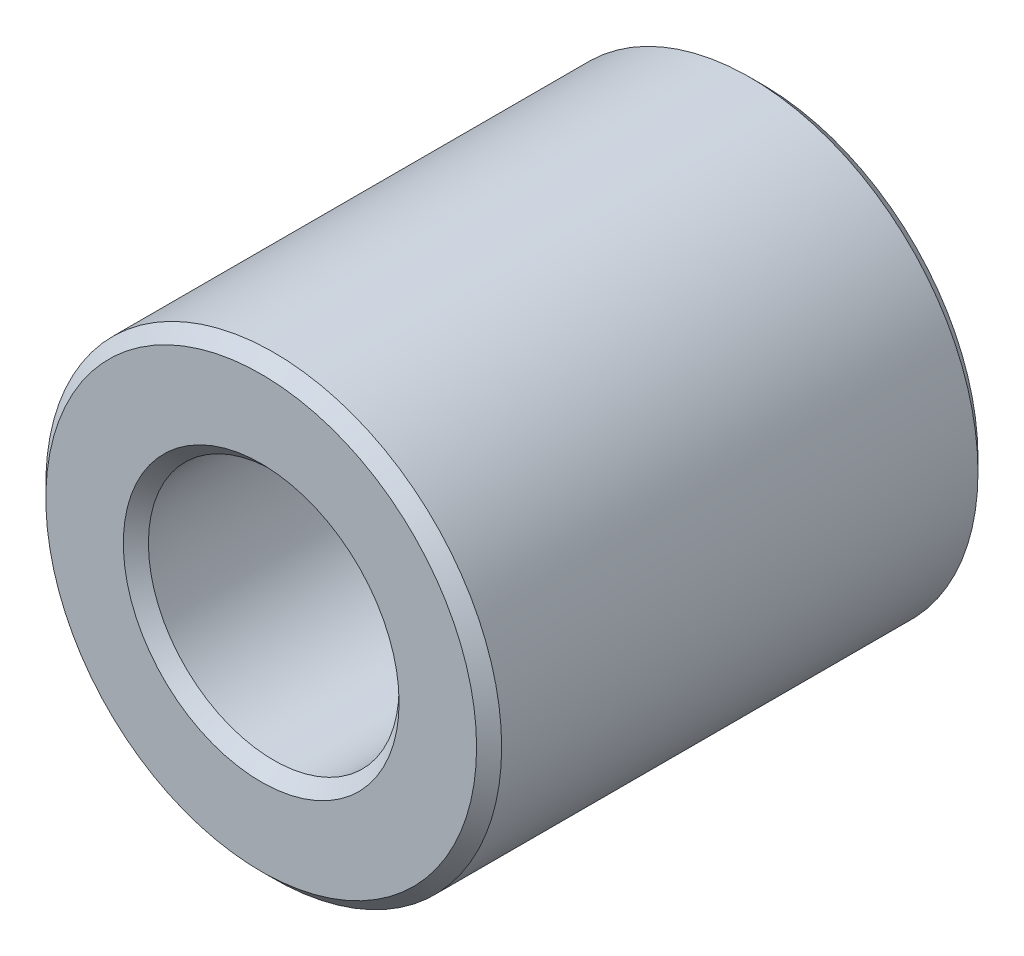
SolidWorks part; units mm, degrees
ref_plane "Front Plane" through (0, 0, 0) normal (0, 0, 1) x (1, 0, 0)
ref_plane "Top Plane" through (0, 0, 0) normal (0, 1, 0) x (1, 0, 0)
ref_plane "Right Plane" through (0, 0, 0) normal (1, 0, 0) x (0, 0, -1)
sketch "Sketch1" plane through (0, 0, 0) normal (0, 0, 1) x (1, 0, 0)
  circle A0 centre (0, 0) radius 22
  circle A1 centre (0, 0) radius 40
  dimension "D1" = 44
  dimension "D2" = 80
extrude "Boss-Extrude1" add sketch "Sketch1" along normal mid plane 88
chamfer "Chamfer1" distance 2.2 angle 45 4 edges at (22, 0, -44) (40, 0, -44) (22, 0, 44) (40, 0, 44)
